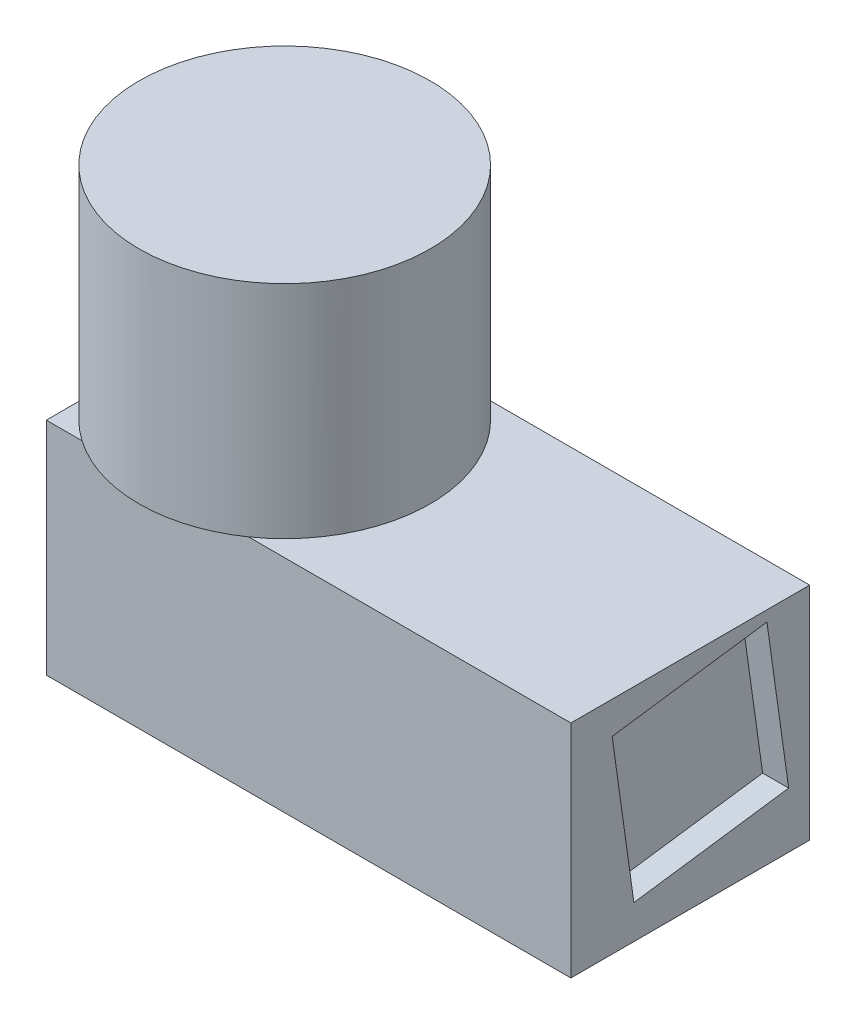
SolidWorks part; units mm, degrees
ref_plane "Front Plane" through (0, 0, 0) normal (0, 0, 1) x (1, 0, 0)
ref_plane "Top Plane" through (0, 0, 0) normal (0, 1, 0) x (1, 0, 0)
ref_plane "Right Plane" through (0, 0, 0) normal (1, 0, 0) x (0, 0, -1)
sketch "Sketch1" plane through (0, 0, 0) normal (0, 1, 0) x (1, 0, 0)
  line L0 (-63.9483, -29.1126) -> (63.9483, -29.1126)
  line L1 (-63.9483, -29.1126) -> (-63.9483, 29.1126)
  line L2 (63.9483, -29.1126) -> (63.9483, 29.1126)
  line L3 (-63.9483, 29.1126) -> (63.9483, 29.1126)
  line L4 (-63.9483, -29.1126) -> (63.9483, 29.1126) construction
  line L5 (63.9483, -29.1126) -> (-63.9483, 29.1126) construction
  point P1 (0, 0)
extrude "Boss-Extrude1" add sketch "Sketch1" along normal blind 53.848
sketch "Sketch2" plane through (0, 53.848, 0) normal (0, 1, 0) x (1, 0, 0)
  circle A0 centre (0, 0) radius 22.7945
extrude "Boss-Extrude2" add sketch "Sketch2" along normal blind 53.848
sketch "Sketch3" plane through (63.9483, 0, 0) normal (1, 0, 0) x (0, 0, -1)
  line L0 (-29.1126, 53.848) -> (29.1126, 0) construction
  line L1 (-19.05, 45.974) -> (19.05, 45.974)
  line L2 (-19.05, 45.974) -> (-19.05, 7.874)
  line L3 (-19.05, 7.874) -> (19.05, 7.874)
  line L4 (19.05, 45.974) -> (19.05, 7.874)
  line L5 (-19.05, 7.874) -> (19.05, 45.974) construction
  point P8 (0, 26.924)
  dimension "D1" = 38.1
extrude "Cut-Extrude1" cut sketch "Sketch3" against normal blind 6.35
other "Move Face4" parameters "D1"=12.7
other "Move Face5" parameters "D1"=27.9617
other "Move Face6" parameters "D1"=6.9814
other "Move Face7" parameters "D1"=8
